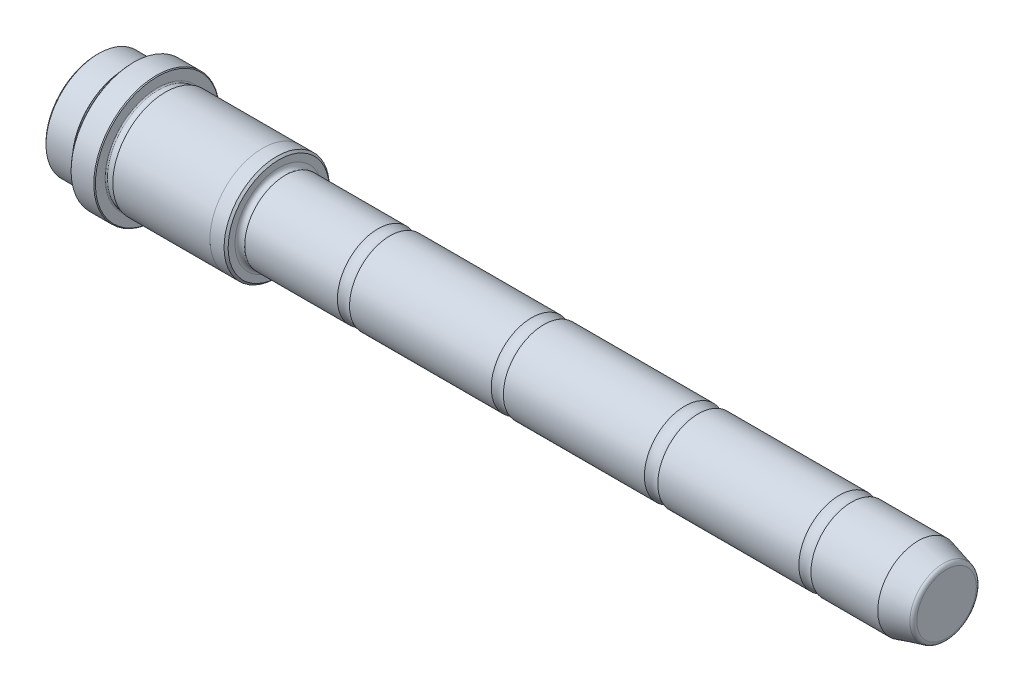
SolidWorks part; units mm, degrees
ref_plane "Front Plane" through (0, 0, 0) normal (0, 0, 1) x (1, 0, 0)
ref_plane "Top Plane" through (0, 0, 0) normal (0, 1, 0) x (1, 0, 0)
ref_plane "Right Plane" through (0, 0, 0) normal (1, 0, 0) x (0, 0, -1)
sketch "Sketch1" plane through (0, 0, 0) normal (0, 0, 1) x (1, 0, 0)
  line L0 (165, 8.1244) -> (158, 10)
  line L1 (158, 10) -> (1.6, 10)
  line L2 (0, 10.8) -> (0, 13)
  line L3 (0, 13) -> (-4, 13)
  line L4 (-28, 13.0001) -> (-28, 12.9)
  line L5 (-28.3, 12.6) -> (-29.7, 12.6)
  line L6 (-30, 12.9) -> (-30, 15.5)
  line L7 (-30, 15.5) -> (-36, 15.5)
  line L8 (-36, 15.5) -> (-36, 12.9)
  line L9 (-36.3, 12.6) -> (-37.7, 12.6)
  line L10 (-38, 12.9) -> (-38, 13)
  line L11 (-38, 13) -> (-45, 13)
  line L12 (-45, 13) -> (-45, 0)
  line L13 (165, 8.1244) -> (165, 0)
  line L14 (165, 0) -> (-165, 0) construction
  line L15 (165, 0) -> (-45, 0)
  line L16 (-4, 13.0001) -> (-28, 13.0001)
  line L17 (-4, 13.0001) -> (-4, 13)
  arc A0 (0, 10.8) -> (1.6, 10) centre (1, 10.8) ccw
  arc A1 (-36, 12.9) -> (-36.3, 12.6) centre (-36.3, 12.9) cw
  arc A2 (-37.7, 12.6) -> (-38, 12.9) centre (-37.7, 12.9) cw
  arc A3 (-29.7, 12.6) -> (-30, 12.9) centre (-29.7, 12.9) cw
  arc A4 (-28, 12.9) -> (-28.3, 12.6) centre (-28.3, 12.9) cw
  point P16 (0, 0)
  point P28 (-30, 12.6)
  point P31 (-28, 12.6)
  dimension "ShoulderRadii" = 2
  dimension "D5" = 0.3
  dimension "D1" = 15
  dimension "D2" = 0.4
  dimension "PinDia" = 20
  dimension "ChamferLeadIn" = 7
  dimension "ShoulderDia" = 26
  dimension "PinLengthN" = 165
  dimension "ShoulderLength" = 36
  dimension "D3" = 0.0001
  dimension "ShoulderGap" = 2
  dimension "D4" = 4
  dimension "T" = 6
  dimension "CollarLength" = 9
  dimension "HeadDia" = 31
  dimension "D8" = 0.2
revolve "Revolve1" add sketch "Sketch1" angle 360 about L14
sketch "Sketch2" plane through (0, 0, 0) normal (0, 0, 1) x (1, 0, 0)
  line L0 (165, -8.1244) -> (165, 8.1244) construction
  line L1 (145.9417, 9.6) -> (148.0583, 9.6) construction
  line L2 (158, 10) -> (1.6, 10) construction
  line L4 (138.5033, 10) -> (141.4967, 10)
  arc A0 (138.5033, 10) -> (141.4967, 10) centre (140, 12.6) ccw
  dimension "GrooveRadius" = 3
  dimension "D3" = 0.4
  dimension "AGroove" = 25
revolve "Groove A" cut sketch "Sketch2" angle 360 about axis through (165, 0, 0) along (1, 0, 0)
sketch "Sketch3" plane through (0, 0, 0) normal (0, 0, 1) x (1, 0, 0)
  line L0 (138.5033, 10) -> (1.6, 10) construction
  line L3 (100.3417, 10) -> (103.6583, 10)
  arc A0 (100.3417, 10) -> (103.6583, 10) centre (102, 12.5) ccw
  arc A1 (138.5033, 10) -> (141.4967, 10) centre (140, 12.6) ccw construction
  dimension "D1" = 0.5
  dimension "GroovePitch" = 38
revolve "Groove B" cut sketch "Sketch3" angle 360 about axis through (165, 0, 0) along (1, 0, 0)
sketch "Sketch4" plane through (0, 0, 0) normal (0, 0, 1) x (1, 0, 0)
  line L2 (100.3417, 10) -> (1.6, 10) construction
  line L3 (62.5033, 10) -> (65.4967, 10)
  arc A0 (62.5033, 10) -> (65.4967, 10) centre (64, 12.6) ccw
  arc A3 (100.3417, 10) -> (103.6583, 10) centre (102, 12.5) ccw construction
  dimension "D1" = 0.4
revolve "Groove C" cut sketch "Sketch4" angle 360 about axis through (165, 0, 0) along (1, 0, 0)
sketch "Sketch5" plane through (0, 0, 0) normal (0, 0, 1) x (1, 0, 0)
  line L0 (24.5033, 10) -> (27.4967, 10)
  line L1 (62.5033, 10) -> (1.6, 10) construction
  arc A0 (24.5033, 10) -> (27.4967, 10) centre (26, 12.6) ccw
  arc A3 (62.5033, 10) -> (65.4967, 10) centre (64, 12.6) ccw construction
  dimension "D1" = 0.4
revolve "Groove D" cut sketch "Sketch5" angle 360 about axis through (165, 0, 0) along (1, 0, 0)
fillet "Fillet1" radius 1 1 edges at (165, 8.1244, 0)
chamfer "Chamfer1" distance 0.2 angle 45 2 edges at (-36, 15.5, 0) (-30, 15.5, 0)
chamfer "Chamfer2" distance 0.5 angle 45 2 edges at (-45, 13, 0) (0, 13, 0)
